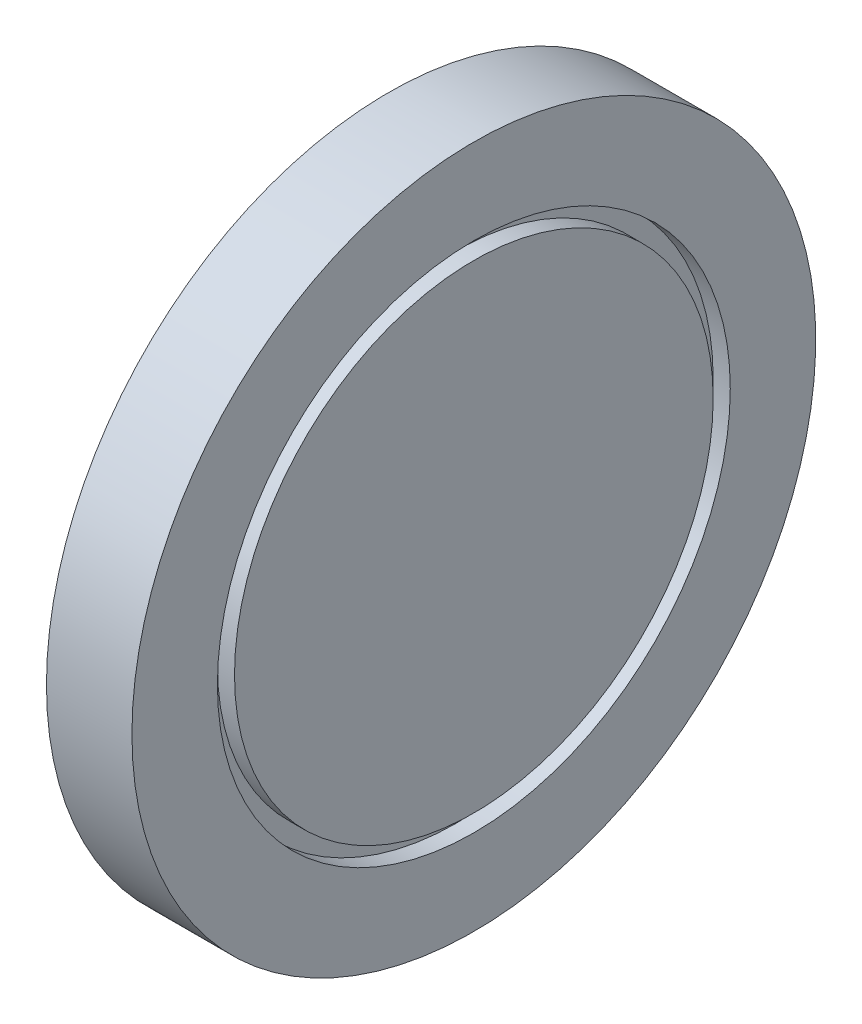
SolidWorks part; units mm, degrees
ref_plane "Front Plane" through (0, 0, 0) normal (0, 0, 1) x (1, 0, 0)
ref_plane "Top Plane" through (0, 0, 0) normal (0, 1, 0) x (1, 0, 0)
ref_plane "Right Plane" through (0, 0, 0) normal (1, 0, 0) x (0, 0, -1)
sketch "Sketch1" plane through (0, 0, 0) normal (0, 0, 1) x (1, 0, 0)
  line L0 (-63.852, 0) -> (71.5451, 0) construction
  line L2 (0, 0) -> (25, 0)
  line L3 (0, 0) -> (0, 100)
  line L4 (0, 100) -> (25, 100)
  line L5 (25, 0) -> (25, 100)
  dimension "D1" = 200
  dimension "D2" = 25
revolve "Revolve1" add sketch "Sketch1" angle 360 about L0
sketch "Sketch4" plane through (25, 0, 0) normal (1, 0, 0) x (0, 0, -1)
  circle A0 centre (0, 0) radius 70
  circle A1 centre (0, 0) radius 75
  circle A2 centre (0, 0) radius 100 construction
  dimension "D1" = 25
  dimension "D2" = 5
extrude "Cut-Extrude2" cut sketch "Sketch4" against normal blind 5
sketch "Sketch2" plane through (0, 0, 0) normal (-1, 0, 0) x (0, 0, 1)
  circle A0 centre (0, 0) radius 3.5
  dimension "D1" = 7
extrude "Boss-Extrude1" add sketch "Sketch2" along normal blind 35
sketch "Sketch3" plane through (0, 0, 0) normal (0, 0, 1) x (1, 0, 0)
  circle A0 centre (-31.2872, 0) radius 1.5
  dimension "D1" = 3
extrude "Cut-Extrude1" cut sketch "Sketch3" against normal through all and the other way through all
